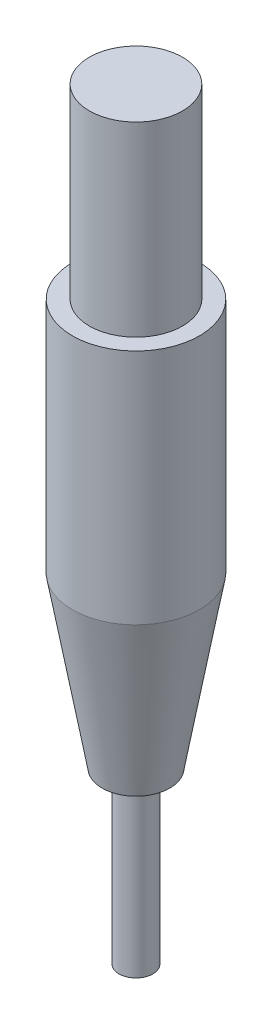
SolidWorks part; units mm, degrees
ref_plane "Plan de face" through (0, 0, 0) normal (0, 0, 1) x (1, 0, 0)
ref_plane "Plan de dessus" through (0, 0, 0) normal (0, 1, 0) x (1, 0, 0)
ref_plane "Plan de droite" through (0, 0, 0) normal (1, 0, 0) x (0, 0, -1)
sketch "Esquisse1" plane through (0, 0, 0) normal (1, 0, 0) x (0, 0, -1)
  line L0 (0, 32.036) -> (0, -27.262) construction
  line L1 (0, 4.6243) -> (-1, 4.6243)
  line L2 (-1, 4.6243) -> (-1, 14.6243)
  line L3 (-1, 14.6243) -> (-2, 14.6243)
  line L4 (-2, 14.6243) -> (-3.75, 24.6243)
  line L5 (-3.75, 24.6243) -> (-3.75, 38.6243)
  line L6 (-3.75, 38.6243) -> (-2.75, 38.6243)
  line L7 (-2.75, 38.6243) -> (-2.75, 49.6243)
  line L8 (-2.75, 49.6243) -> (0, 49.6243)
  line L9 (0, 49.6243) -> (0, 4.6243)
  dimension "D1" = 2.75
  dimension "D2" = 11
  dimension "D3" = 14
  dimension "D6" = 10
  dimension "D8" = 10
revolve "Révolution1" add sketch "Esquisse1" angle 360 about L0
